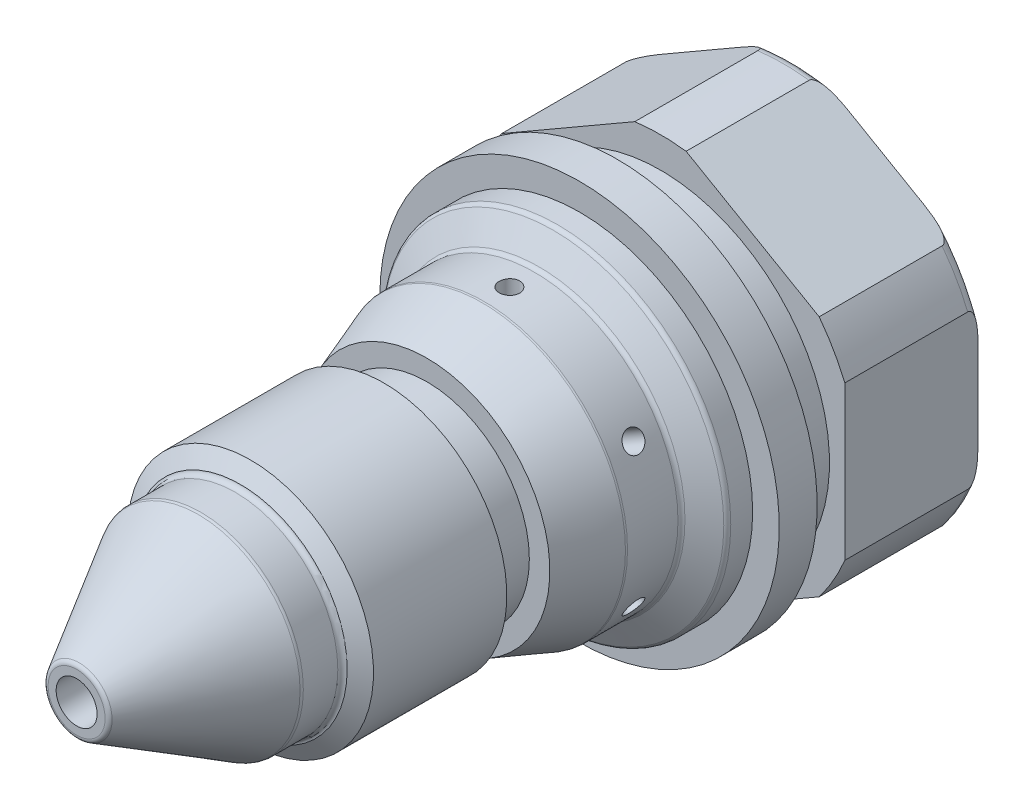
SolidWorks part; units mm, degrees
ref_plane "Front Plane" through (0, 0, 0) normal (0, 0, 1) x (1, 0, 0)
ref_plane "Top Plane" through (0, 0, 0) normal (0, 1, 0) x (1, 0, 0)
ref_plane "Right Plane" through (0, 0, 0) normal (1, 0, 0) x (0, 0, -1)
sketch "Sketch2" plane through (0, 0, 0) normal (0, 1, 0) x (1, 0, 0)
  line L0 (0, 0) -> (0, 35) construction
  line L1 (0, 35) -> (0, 0) construction
  line L2 (0, 0) -> (12.5, 0) construction
  line L3 (9.75, 28.5) -> (9.75, 35)
  line L4 (0, 0) -> (1.5359, 0)
  line L5 (1.5359, 0) -> (5, 6)
  line L6 (5, 6) -> (5, 8)
  line L7 (5, 8) -> (6, 8)
  line L8 (6, 8) -> (6, 15)
  line L9 (6, 15) -> (5, 15)
  line L10 (5, 15) -> (5, 17.1)
  line L11 (7, 19.8475) -> (7, 22.5)
  line L12 (7, 22.5) -> (8.45, 23.3372)
  line L13 (9.75, 24.55) -> (9.75, 26.4)
  line L14 (0, 35) -> (0, 0)
  line L15 (0, 35) -> (9.75, 35)
  line L16 (5, 17.1) -> (6, 17.1)
  line L17 (6, 17.1) -> (7, 19.8475)
  line L18 (9.75, 26.4) -> (8.25, 26.4)
  line L20 (9.75, 28.5) -> (8.25, 28.5)
  line L21 (8.25, 26.4) -> (8.25, 28.5)
  line L22 (8.45, 23.3372) -> (8.45, 24.55)
  line L23 (8.45, 24.55) -> (9.75, 24.55)
  point P20 (5.5, 15)
  dimension "D2" = 19.5
  dimension "D3" = 2.1
  dimension "D4" = 60
  dimension "D5" = 14
  dimension "D6" = 12
  dimension "D7" = 10
  dimension "D8" = 30
  dimension "D9" = 2.1
  dimension "D10" = 1
  dimension "D11" = 20
  dimension "D12" = 6
  dimension "D13" = 8
  dimension "D14" = 15
  dimension "D15" = 35
  dimension "D16" = 22.5
  dimension "D17" = 1.85
  dimension "D18" = 1.3
  dimension "D19" = 6.5
  dimension "D21" = 1.5
revolve "Revolve1" add sketch "Sketch2" angle 360 about L14
sketch "Sketch3" plane through (0, 0, 0) normal (0, 0, 1) x (1, 0, 0)
  circle A0 centre (0, 0) radius 1
  dimension "D1" = 2
extrude "Cut-Extrude1" cut sketch "Sketch3" against normal blind 23
sketch "Sketch4" plane through (0, 0, -35) normal (0, 0, -1) x (-1, 0, 0)
  circle A0 centre (0, 0) radius 4
  dimension "D1" = 8
extrude "Cut-Extrude3" cut sketch "Sketch4" against normal blind 23
sketch "Sketch10" plane through (0, 0, -35) normal (0, 0, -1) x (-1, 0, 0)
  circle A0 centre (0, 0) radius 6
  circle A1 centre (0, 0) radius 9.75 construction
  dimension "D1" = 12
extrude "Cut-Extrude4" cut sketch "Sketch10" against normal blind 10
chamfer "Chamfer1" distance 1 angle 60 1 edges at (-6, 0, -35)
chamfer "Chamfer2" distance 2.75 angle 45 1 edges at (-4, 0, -12)
chamfer "Chamfer4" distance 3 angle 45 1 edges at (-4, 0, -25)
fillet "Fillet9" radius 0.5 1 edges at (-9.75, 0, -35)
fillet "Fillet10" radius 0.25 6 edges at (-7, 0, -19.8475) (-7, 0, -22.5) (-5, 0, -6) (-5, 0, -8) (-1.5359, 0, 0) (-8.45, 0, -23.3372)
ref_plane "Plane1" through (0, 10, 0) normal (0, 1, 0) x (1, 0, 0)
hole_wizard "Ø1.0 (1) Diameter Hole1" positions "Sketch6" profile "Sketch7" hole size "Ø1.0" standard "ANSI Metric"
sketch "Sketch6" plane through (0, 10, 0) normal (0, 1, 0) x (1, 0, 0)
  line L0 (0, 0) -> (0, 21.1236) construction
  line L1 (-7, 21.1236) -> (7, 21.1236) construction
  line L4 (7, 19.8916) -> (7, 22.3557) construction
  line L5 (-7, 22.3557) -> (-7, 19.8916) construction
  point P0 (0, 21.1236)
sketch "Sketch7" plane through (0, 10, -21.1236) normal (1, 0, 0) x (0, 0, 1)
  line L0 (0, 0) -> (0, 6)
  line L1 (0, 6) -> (0.5, 6)
  line L2 (0.5, 6) -> (0.5, 0)
  line L5 (0.5, 0) -> (0, 0)
  line L11 (0, -6.35) -> (0, 107.95) construction
  dimension "Thru Hole Dia." = 1
  dimension "Thru Hole Depth" = 6
pattern_circular "CirPattern1" count 6 over 360 about axis through (0, 0, -35) along (0, 0, -1) of "Ø1.0 (1) Diameter Hole1"
sketch3d "CAMWorksSketchPoint"
  point P0 (-245.0099, -526, -385)
  point P1 (359, 394, 698.5)
chamfer "Chamfer3" distance 0.5 angle 60 1 edges at (-6, 0, -8)
fillet "Fillet11" radius 0.5 1 edges at (-4, 0, -14.75)
sketch "Sketch11" plane through (0, 0, -35) normal (0, 0, -1) x (-1, 0, 0)
  line L1 (0, 10.3923) -> (-9, 5.1962)
  line L2 (-9, 5.1962) -> (-9, -5.1962)
  line L3 (-9, -5.1962) -> (0, -10.3923)
  line L4 (0, -10.3923) -> (9, -5.1962)
  line L5 (9, -5.1962) -> (9, 5.1962)
  line L6 (9, 5.1962) -> (0, 10.3923)
  circle A0 centre (0, 0) radius 9 construction
  circle A1 centre (0, 0) radius 12.7566
  dimension "D1" = 18
extrude "Cut-Extrude5" cut sketch "Sketch11" against normal blind 6.5
